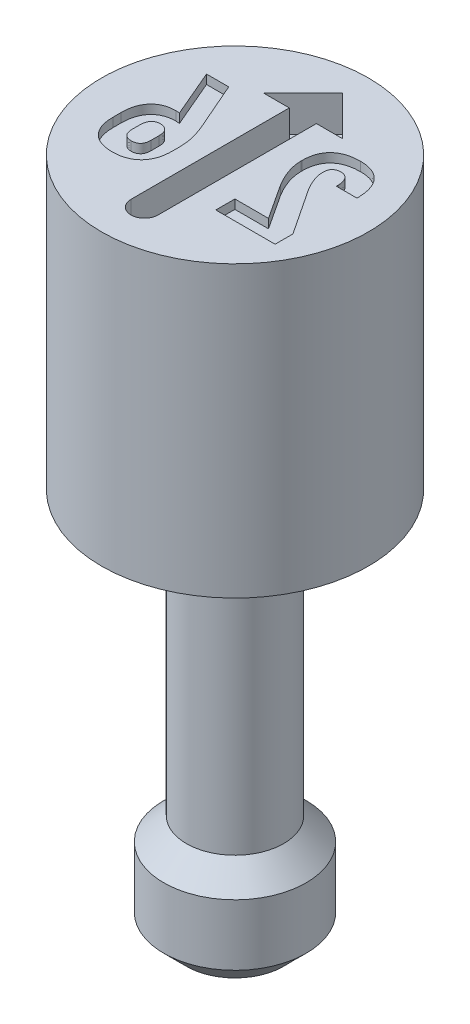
SolidWorks part; units mm, degrees
ref_plane "Front Plane" through (0, 0, 0) normal (0, 0, 1) x (1, 0, 0)
ref_plane "Top Plane" through (0, 0, 0) normal (0, 1, 0) x (1, 0, 0)
ref_plane "Right Plane" through (0, 0, 0) normal (1, 0, 0) x (0, 0, -1)
sketch "Sketch1" plane through (0, 0, 0) normal (0, 0, 1) x (1, 0, 0)
  line L0 (0, 7.62) -> (1.4986, 7.62)
  line L1 (0, -1.6485) -> (0, 1.6485) construction
  line L2 (1.4986, 7.62) -> (1.4986, 4.3688)
  line L3 (1.4986, 4.3688) -> (0.5461, 4.3688)
  line L4 (0.5461, 4.3688) -> (0.5461, 1.1938)
  line L5 (0.5461, 1.1938) -> (0.8, 0.9399)
  line L6 (0.8, 0.9399) -> (0.8, 0.254)
  line L7 (0.8, 0.254) -> (0.546, 0)
  line L8 (1.6485, 0) -> (-1.6485, 0) construction
  line L9 (0.546, 0) -> (0, 0)
  line L10 (0, 0) -> (0, 7.62)
  line L11 (0, 0) -> (0, 64.9194) construction
  dimension "D1" = 7.62
  dimension "D2" = 1.1938
  dimension "D3" = 0.254
  dimension "D4" = 45
  dimension "D5" = 1.6
  dimension "D6" = 2.9972
  dimension "D7" = 1.0922
  dimension "D8" = 3.2512
revolve "Revolve1" add sketch "Sketch1" angle 360 about L11
sketch "Sketch2" plane through (0, 7.62, 0) normal (0, 1, 0) x (1, 0, 0)
  line L1 (0.1524, -1.016) -> (0.1524, 0.762)
  line L2 (-0.1524, -1.016) -> (-0.1524, 0.762)
  line L3 (0, -1.6485) -> (0, 1.6485) construction
  line L4 (-0.1524, 0.762) -> (-0.4445, 0.762)
  line L5 (0.1524, 0.762) -> (0.4445, 0.762)
  line L6 (0.4445, 0.762) -> (0, 1.2065)
  line L7 (0, 1.2065) -> (-0.4445, 0.762)
  line L8 (-1.6485, 0) -> (1.6485, 0) construction
  arc A0 (-0.1524, -1.016) -> (0.1524, -1.016) centre (0, -1.016) ccw
  dimension "D6" = 1.016
  dimension "D1" = 0.3048
  dimension "D3" = 0.889
  dimension "D4" = 0.4445
  dimension "D5" = 45
  dimension "D7" = 0.762
extrude "Cut-Extrude1" cut sketch "Sketch2" against normal blind 0.4064
sketch "Sketch3" plane through (0, 7.62, 0) normal (0, 1, 0) x (1, 0, 0)
  text T0 "2 6" font "Bahnschrift SemiCondensed" height 1.27
extrude "Cut-Extrude2" cut sketch "Sketch3" against normal blind 0.1016
